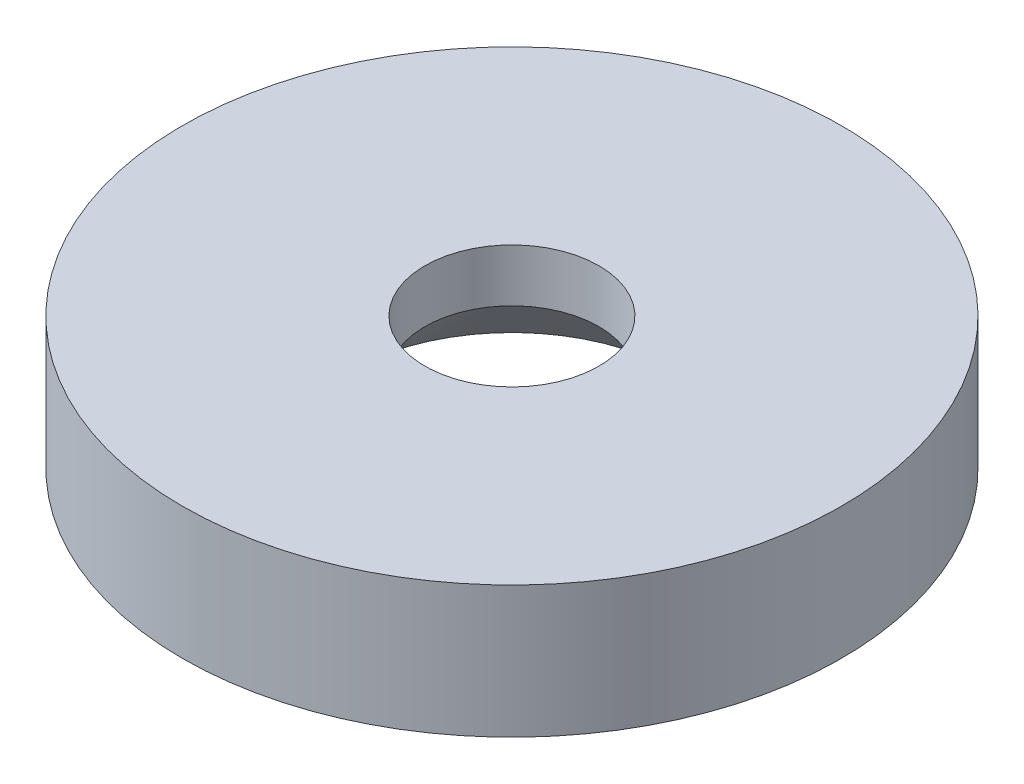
SolidWorks part; units mm, degrees
ref_plane "Front Plane" through (0, 0, 0) normal (0, 0, 1) x (1, 0, 0)
ref_plane "Top Plane" through (0, 0, 0) normal (0, 1, 0) x (1, 0, 0)
ref_plane "Right Plane" through (0, 0, 0) normal (1, 0, 0) x (0, 0, -1)
sketch "Sketch1" plane through (0, 0, 0) normal (0, 1, 0) x (1, 0, 0)
  circle A0 centre (0, 0) radius 12.5
  dimension "D1" = 25
extrude "Boss-Extrude1" add sketch "Sketch1" along normal blind 5
hole_wizard "CSK for M6 Flat Head Machine Screw1" positions "Sketch2" profile "Sketch3" countersink size "M6" standard "ANSI Metric"
sketch "Sketch2" plane through (0, 0, 0) normal (0, -1, 0) x (-1, 0, 0)
  point P0 (0, 0)
sketch "Sketch3" plane through (0, 0, 0) normal (1, 0, 0) x (0, 0, -1)
  line L0 (0, 0) -> (0, 5)
  line L1 (0, 5) -> (3.3, 5)
  line L2 (3.3, 5) -> (3.3, 3)
  line L3 (3.3, 3) -> (6.3, 0)
  line L5 (6.3, 0) -> (0, 0)
  line L6 (-3.3, 3) -> (-6.3, 0) construction
  line L11 (0, -6.35) -> (0, 107.95) construction
  dimension "Thru Hole Dia." = 6.6
  dimension "Thru Hole Depth" = 5
  dimension "Near C'Sink Dia." = 12.6
  dimension "Near C'Sink Angle" = 90
